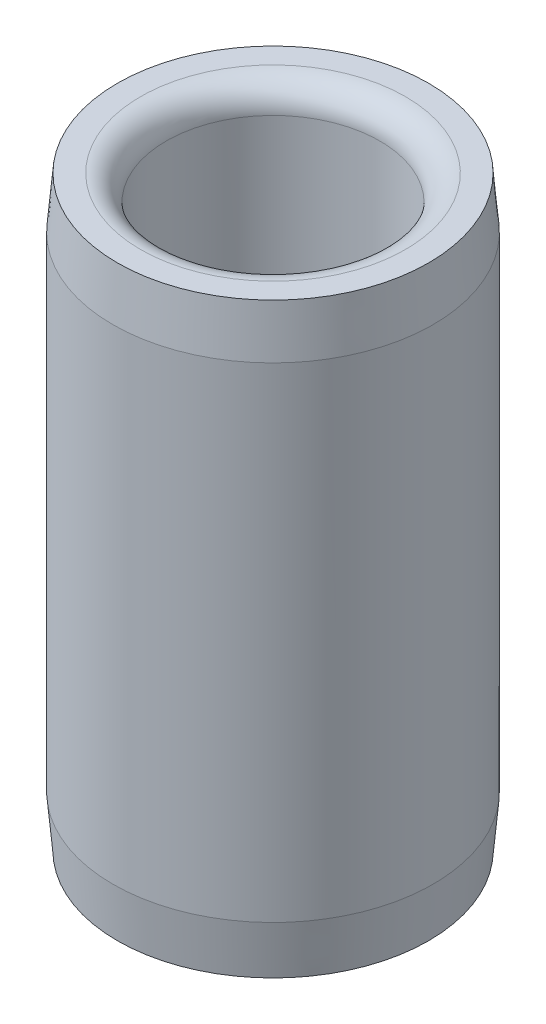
SolidWorks part; units mm, degrees
ref_plane "Front Plane" through (0, 0, 0) normal (0, 0, 1) x (1, 0, 0)
ref_plane "Top Plane" through (0, 0, 0) normal (0, 1, 0) x (1, 0, 0)
ref_plane "Right Plane" through (0, 0, 0) normal (1, 0, 0) x (0, 0, -1)
sketch "Sketch2" plane through (0, 0, 0) normal (0, 0, 1) x (1, 0, 0)
  line L0 (0, 20.0805) -> (0, -8.1046) construction
  line L1 (-6.3563, 0) -> (-9.525, 0)
  line L2 (-9.525, 0) -> (-9.525, 34.925)
  line L3 (-9.525, 34.925) -> (-6.3564, 34.925)
  line L4 (-6.3564, 34.925) -> (-6.3563, 0)
  dimension "D1" = 12.7127
  dimension "D2" = 19.05
  dimension "D3" = 34.925
revolve "Revolve1" add sketch "Sketch2" angle 360 about L0
chamfer "Chamfer1" [suppressed] distance 1.524 angle 15
chamfer "Chamfer2" distance 3.048 angle 5 2 edges at (0, 0, 9.525) (0, 34.925, 9.525)
fillet "Fillet1" radius 1.524 2 edges at (0, 0, 6.3563) (0, 34.925, 6.3564)
